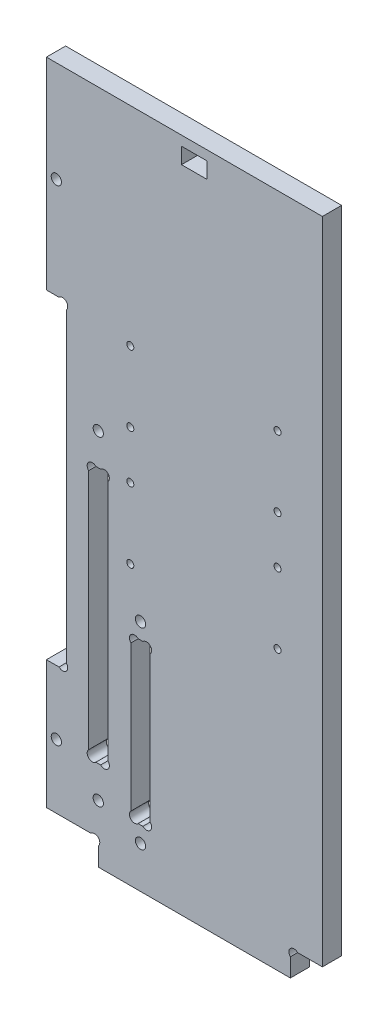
SolidWorks part; units mm, degrees
ref_plane "Face" through (0, 0, 0) normal (0, 0, 1) x (1, 0, 0)
ref_plane "Dessus" through (0, 0, 0) normal (0, 1, 0) x (1, 0, 0)
ref_plane "Droite" through (0, 0, 0) normal (1, 0, 0) x (0, 0, -1)
sketch "Esquisse1" plane through (0, 0, 0) normal (0, 0, 1) x (1, 0, 0)
  line L0 (6.2, 50) -> (-11.8335, 68.0335) construction
  line L1 (52.1814, 30) -> (-9.448, 30) construction
  line L2 (-11.8335, 213) -> (181.5225, 213) construction
  line L3 (19.2, -24.1458) -> (19.2, 175.2601) construction
  line L4 (3.1, 195.3951) -> (3.1, 25.1877) construction
  line L5 (0, -24.1458) -> (0, 271.6778) construction
  line L6 (-28.0225, 0) -> (104.828, 0) construction
  line L7 (-28.0225, 10) -> (181.5225, 10) construction
  line L8 (-20.6308, 50) -> (11.2604, 50) construction
  line L9 (-28.0225, 100) -> (29.4468, 100) construction
  line L10 (6.2, -12.8708) -> (6.2, 195.3951) construction
  line L11 (13.2, -24.1458) -> (13.2, 175.2601) construction
  line L12 (3.9373, 50) -> (0, 50)
  line L13 (0, 50) -> (0, 10)
  line L14 (26.4, -24.1458) -> (26.4, 85.3825) construction
  line L15 (32.4, -24.1458) -> (32.4, 85.3825) construction
  line L16 (0, 150) -> (0, 213)
  line L17 (3.9373, 150) -> (0, 150)
  line L18 (6.2, 147.7373) -> (6.2, 52.2627)
  line L19 (9.7007, 70) -> (52.1814, 70) construction
  line L20 (76.2, 14.9724) -> (76.2, -19.1604) construction
  line L21 (46.2, 14.9724) -> (46.2, -19.1604) construction
  line L22 (12.9185, 20) -> (47.6401, 20) construction
  line L23 (23.5203, 45) -> (47.6401, 45) construction
  line L24 (86.2, -19.1604) -> (86.2, 271.6778) construction
  line L25 (13.2, 30) -> (18.8062, 35.6062) construction
  line L26 (26.4, 20) -> (39.5194, 33.1194) construction
  line L27 (29.4, 53.193) -> (29.4, 11.8269) construction
  line L28 (16.2, 17.9355) -> (16.2, 128.2352) construction
  line L29 (15.4627, 110) -> (16.9373, 110)
  line L30 (19.2, 107.7373) -> (19.2, 32.2627)
  line L31 (13.2, 107.7373) -> (13.2, 32.2627)
  line L32 (15.4627, 30) -> (16.9373, 30)
  line L33 (28.6627, 70) -> (30.1373, 70)
  line L34 (32.4, 67.7373) -> (32.4, 22.2627)
  line L35 (30.1373, 20) -> (28.6627, 20)
  line L36 (0, 213) -> (86.2, 213)
  line L37 (26.4, 22.2627) -> (26.4, 67.7373)
  line L38 (23.5203, 15) -> (38.2153, 15) construction
  line L39 (76.2, 10) -> (96.8367, -10.6367) construction
  line L40 (16.2, -4.5234) -> (16.2, 15) construction
  line L41 (0, 10) -> (13.9373, 10)
  line L42 (16.2, 7.7373) -> (16.2, 2)
  line L44 (76.2, 2) -> (76.2, 7.7373)
  line L45 (78.4627, 10) -> (86.2, 10)
  line L46 (86.2, 10) -> (86.2, 213)
  line L47 (100.2626, 210) -> (23.5203, 210) construction
  line L48 (100.2626, 205) -> (23.5203, 205) construction
  line L49 (46.2, 247.4421) -> (46.2, 193.4716) construction
  line L50 (50.2, 183.6075) -> (50.2, 216.9191) construction
  line L51 (42.2, 183.6075) -> (42.2, 216.9191) construction
  line L52 (0, 181.5) -> (15, 181.5) construction
  line L53 (42.2, 210) -> (50.2, 210)
  line L54 (42.2, 210) -> (42.2, 205)
  line L55 (42.2, 205) -> (50.2, 205)
  line L56 (50.2, 210) -> (50.2, 205)
  line L57 (134.7395, 89) -> (57.1349, 89) construction
  line L58 (158.6814, 126) -> (57.1349, 126) construction
  line L59 (72.2, 56.1395) -> (72.2, 172.8217) construction
  line L60 (11.2604, 2) -> (78.4627, 2) construction
  line L61 (134.7395, 111) -> (57.1349, 111) construction
  line L62 (134.7395, 148) -> (57.1349, 148) construction
  line L63 (16.2, 2) -> (76.2, 2)
  line L64 (49.2, 167.593) -> (49.2, 159.062) construction
  circle A0 centre (3.1, 30) radius 1.6
  arc A1 (3.9373, 50) -> (6.2, 52.2627) centre (5.0686, 51.1314) ccw
  arc A2 (26.4, 22.2627) -> (28.6627, 20) centre (27.5314, 21.1314) ccw
  arc A3 (3.9373, 150) -> (6.2, 147.7373) centre (5.0686, 148.8686) cw
  circle A4 centre (3.1, 181.5) radius 1.6
  arc A5 (13.2, 32.2627) -> (15.4627, 30) centre (14.3314, 31.1314) ccw
  arc A6 (32.4, 22.2627) -> (30.1373, 20) centre (31.2686, 21.1314) cw
  arc A7 (26.4, 67.7373) -> (28.6627, 70) centre (27.5314, 68.8686) cw
  arc A8 (32.4, 67.7373) -> (30.1373, 70) centre (31.2686, 68.8686) ccw
  arc A9 (19.2, 32.2627) -> (16.9373, 30) centre (18.0686, 31.1314) cw
  arc A10 (19.2, 107.7373) -> (16.9373, 110) centre (18.0686, 108.8686) ccw
  arc A11 (13.2, 107.7373) -> (15.4627, 110) centre (14.3314, 108.8686) cw
  circle A12 centre (29.4, 15) radius 1.6
  circle A13 centre (16.2, 20) radius 1.6
  arc A14 (78.4627, 10) -> (76.2, 7.7373) centre (77.3314, 8.8686) ccw
  arc A15 (13.9373, 10) -> (16.2, 7.7373) centre (15.0686, 8.8686) cw
  circle A16 centre (29.4, 75) radius 1.6
  circle A17 centre (16.2, 120) radius 1.6
  circle A18 centre (72.2, 148) radius 1.1
  circle A19 centre (72.2, 126) radius 1.1
  circle A20 centre (72.2, 111) radius 1.1
  circle A21 centre (72.2, 89) radius 1.1
  circle A22 centre (26.2, 89) radius 1.1
  circle A23 centre (26.2, 111) radius 1.1
  circle A24 centre (26.2, 126) radius 1.1
  circle A25 centre (26.2, 148) radius 1.1
  dimension "D7" = 45
  dimension "D8" = 3.1
  dimension "D9" = 20
  dimension "D13" = 3
  dimension "D10" = 40
  dimension "D16" = 25
  dimension "D17" = 45
  dimension "D19" = 3
  dimension "D24" = 45
  dimension "D25" = 5
  dimension "D31" = 79
  dimension "D2" = 6.2
  dimension "D3" = 10
  dimension "D4" = 40
  dimension "D5" = 90
  dimension "D6" = 86.2
  dimension "D11" = 16.2
  dimension "D12" = 6
  dimension "D14" = 6
  dimension "D15" = 10
  dimension "D18" = 45
  dimension "D20" = 32.4
  dimension "D21" = 10
  dimension "D22" = 30
  dimension "D23" = 5
  dimension "D26" = 203
  dimension "D27" = 40
  dimension "D28" = 8
  dimension "D29" = 4
  dimension "D30" = 3
  dimension "D32" = 116
  dimension "D33" = 22
  dimension "D34" = 22
  dimension "D35" = 14
  dimension "D36" = 8
  dimension "D37" = 23
extrude "Extrusion1" add sketch "Esquisse1" along normal blind 6
